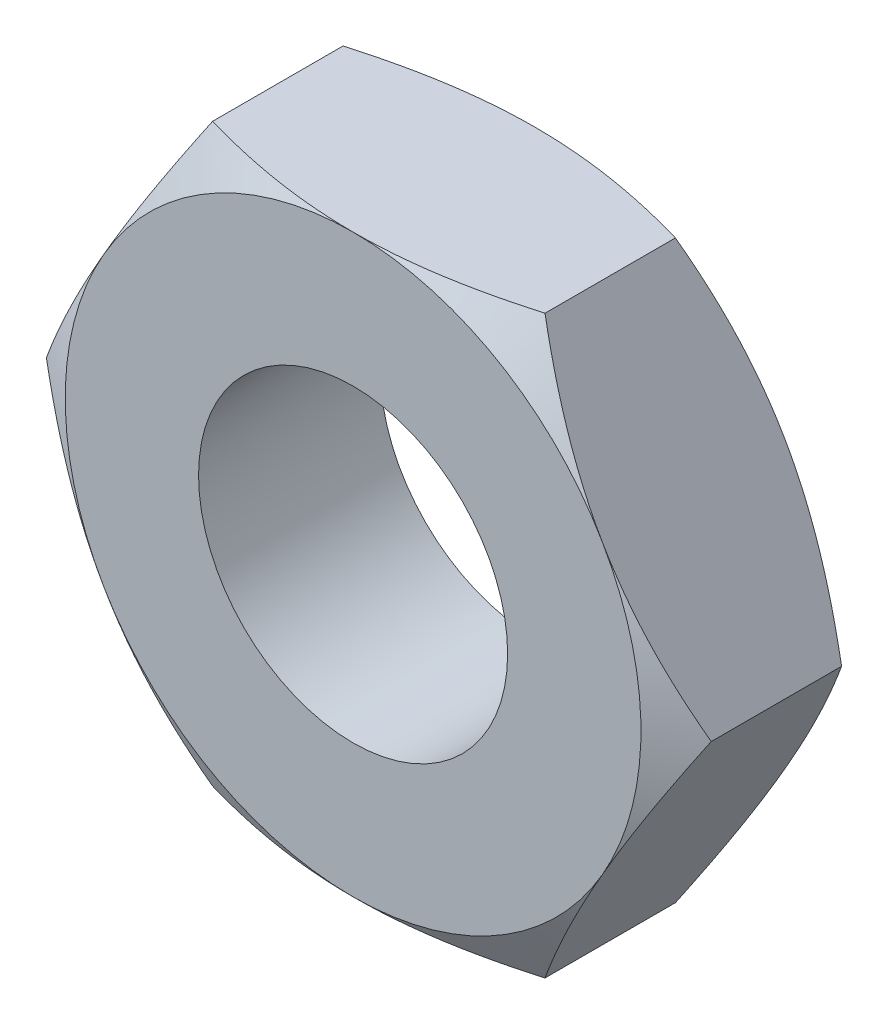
SolidWorks part; units mm, degrees
ref_plane "Front Plane" through (0, 0, 0) normal (0, 0, 1) x (1, 0, 0)
ref_plane "Top Plane" through (0, 0, 0) normal (0, 1, 0) x (1, 0, 0)
ref_plane "Right Plane" through (0, 0, 0) normal (1, 0, 0) x (0, 0, -1)
sketch "Sketch1" plane through (0, 0, 0) normal (0, 0, 1) x (1, 0, 0)
  line L1 (5.4848, 9.5) -> (-5.4848, 9.5)
  line L2 (-5.4848, 9.5) -> (-10.9697, 0)
  line L3 (-10.9697, 0) -> (-5.4848, -9.5)
  line L4 (-5.4848, -9.5) -> (5.4848, -9.5)
  line L5 (5.4848, -9.5) -> (10.9697, 0)
  line L6 (10.9697, 0) -> (5.4848, 9.5)
  circle A0 centre (0, 0) radius 9.5 construction
  dimension "D1" = 19
extrude "Extrude1" add sketch "Sketch1" along normal mid plane 6
sketch "Sketch2" plane through (0, 0, 0) normal (1, 0, 0) x (0, 0, -1)
  line L0 (-3, 9.5) -> (-3, 19)
  line L1 (-3, 19) -> (2.4848, 19)
  line L2 (2.4848, 19) -> (-3, 9.5)
  line L3 (0, 0) -> (6.7182, 0) construction
  dimension "D1" = 30
  dimension "D2" = 19
revolve "Cut-Revolve1" cut sketch "Sketch2" angle 360 about L3
mirror "Mirror1" about plane through (0, 0, 0) normal (0, 0, 1) of "Cut-Revolve1"
hole_wizard " Tapped Hole1" positions "Sketch4" profile "Sketch3" tap size "M12" standard "DIN"
sketch "Sketch4" plane through (0, 0, 3) normal (0, 0, 1) x (1, 0, 0)
  point P0 (0, 0)
sketch "Sketch3" plane through (0, 0, 3) normal (1, 0, 0) x (0, -1, 0)
  line L0 (0, 0) -> (0, 6)
  line L1 (0, 6) -> (5.1, 6)
  line L2 (5.1, 6) -> (5.1, 0)
  line L5 (5.1, 0) -> (0, 0)
  line L11 (0, -6.35) -> (0, 107.95) construction
  dimension "Thru Tap Drill Dia." = 10.2
  dimension "Thru Tap Drill Depth" = 6
